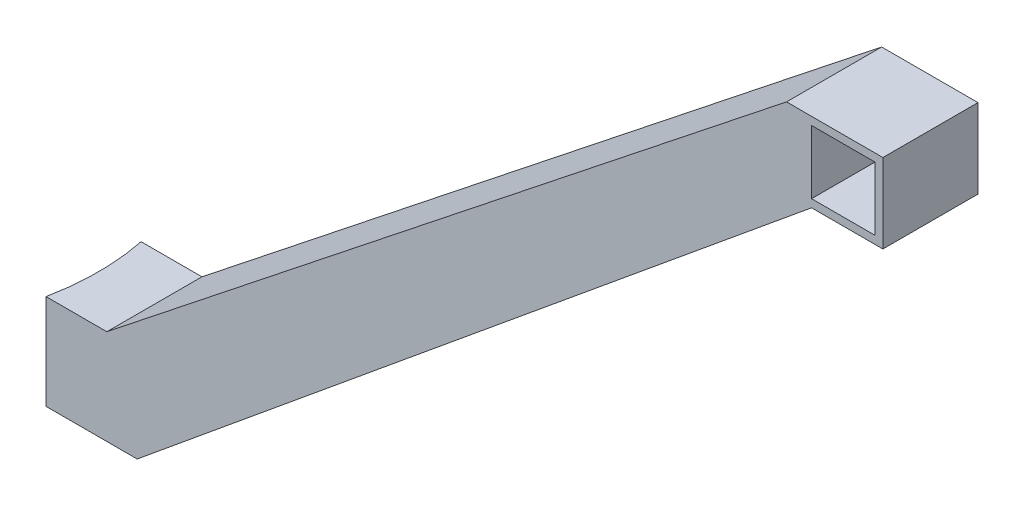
SolidWorks part; units mm, degrees
ref_plane "Plan de face" through (0, 0, 0) normal (0, 0, 1) x (1, 0, 0)
ref_plane "Plan de dessus" through (0, 0, 0) normal (0, 1, 0) x (1, 0, 0)
ref_plane "Plan de droite" through (0, 0, 0) normal (1, 0, 0) x (0, 0, -1)
sketch "Esquisse1" plane through (0, 0, 0) normal (0, 0, 1) x (1, 0, 0)
  line L0 (0, 0) -> (12.6813, 0)
  line L1 (235, 170) -> (227.104, 170)
  line L2 (0, -30) -> (22.248, -30)
  line L3 (22.248, -30) -> (235, 145)
  line L4 (0, 0) -> (0, -30)
  line L5 (235, 147.5) -> (235, 167.5)
  line L6 (227.104, 170) -> (12.6813, 0)
  line L7 (235, 147.5) -> (255, 147.5)
  line L8 (255, 147.5) -> (255, 167.5)
  line L9 (255, 167.5) -> (235, 167.5)
  line L10 (235, 145) -> (257.5, 145)
  line L11 (257.5, 145) -> (257.5, 170)
  line L12 (257.5, 170) -> (235, 170)
  line L13 (12.6813, 0) -> (392.2147, 269.4617) construction
  line L15 (22.248, -30) -> (409.5821, 245) construction
  dimension "D2" = 235
  dimension "D3" = 20
  dimension "D4" = 20
  dimension "D7" = 200
  dimension "D1" = 30
  dimension "D6" = 2.5
extrude "Boss.-Extru.1" add sketch "Esquisse1" along normal blind 30
sketch "Esquisse2" plane through (0, 0, 0) normal (0, 1, 0) x (1, 0, 0)
  line L0 (0, -30) -> (0, 0) construction
  circle A0 centre (-75, -15) radius 75
  dimension "D1" = 150
  dimension "D2" = 0
extrude "Enlèv. mat.-Extru.3" cut sketch "Esquisse2" against normal blind 30
sketch "Esquisse3" plane through (0, 0, 0) normal (-1, 0, 0) x (0, 0, 1)
  line L1 (0, 0) -> (30, 0)
  line L2 (0, 0) -> (0, -30)
  line L3 (0, -30) -> (30, -30)
  line L4 (30, 0) -> (30, -30)
extrude "Boss.-Extru.2" add sketch "Esquisse3" along normal blind 10
sketch "Esquisse4" plane through (0, 0, 0) normal (0, 1, 0) x (1, 0, 0)
  line L0 (-10, -30) -> (-10, 0) construction
  circle A0 centre (-80, -15) radius 75
  dimension "D1" = 150
  dimension "D2" = 70
extrude "Enlèv. mat.-Extru.4" cut sketch "Esquisse4" against normal blind 36
